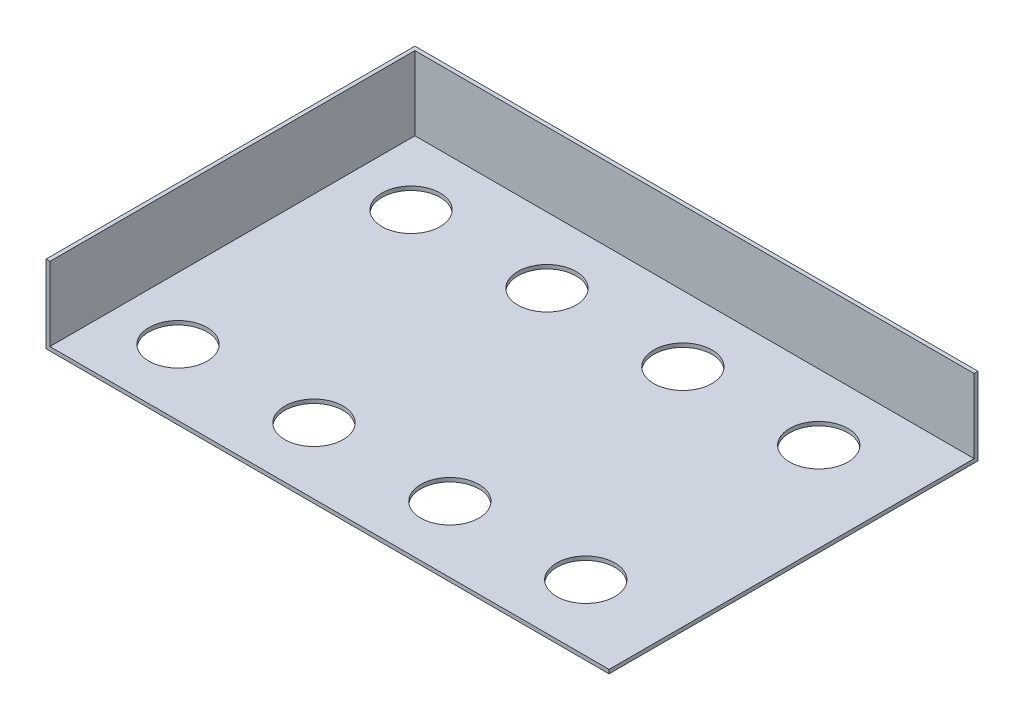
SolidWorks part; units mm, degrees
ref_plane "Front" through (0, 0, 0) normal (0, 0, 1) x (1, 0, 0)
ref_plane "Top" through (0, 0, 0) normal (0, 1, 0) x (1, 0, 0)
ref_plane "Right" through (0, 0, 0) normal (1, 0, 0) x (0, 0, -1)
sketch "Sketch1" plane through (0, 0, 0) normal (0, 1, 0) x (1, 0, 0)
  line L0 (72.5, -47.5) -> (-72.5, 47.5) construction
  line L1 (-72.5, 47.5) -> (72.5, 47.5)
  line L2 (-72.5, 47.5) -> (-72.5, -47.5)
  line L3 (-72.5, -47.5) -> (72.5, -47.5)
  line L4 (72.5, 47.5) -> (72.5, -47.5)
  dimension "D1" = 145
  dimension "D2" = 95
extrude "Extrude1" add sketch "Sketch1" along normal blind 20
shell "Shell1" thickness 1
sketch "Sketch2" plane through (0, 20, 0) normal (0, 1, 0) x (-1, 0, 0)
  line L0 (72.5, -47.5) -> (72.5, 47.5) construction
  line L1 (72.5, 47.5) -> (71.5, 47.5) construction
  circle A0 centre (55.5, 30.5) radius 7.5
  dimension "D3" = 15
  dimension "D1" = 17
  dimension "D2" = 17
extrude "Cut-Extrude2" cut sketch "Sketch2" against normal through all
pattern_linear "LPattern2" count 4 spacing 35 along (1, 0, 0) count 2 spacing 60 along (0, 0, -1) of "Cut-Extrude2"
